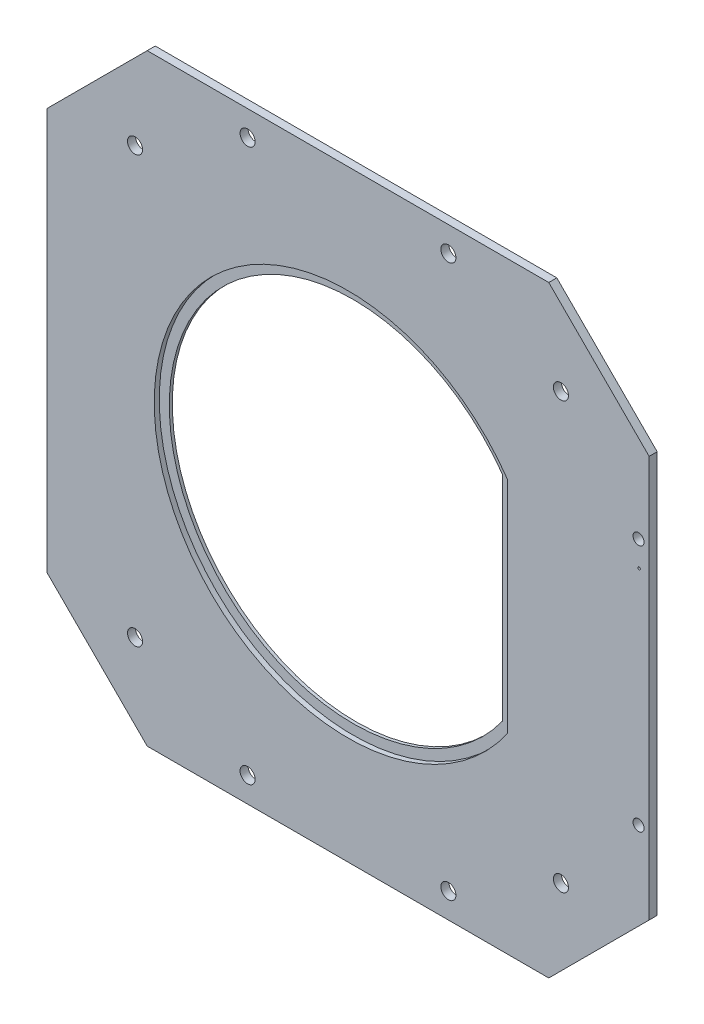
SolidWorks part; units mm, degrees
ref_plane "Front" through (0, 0, 0) normal (0, 0, 1) x (1, 0, 0)
ref_plane "Top" through (0, 0, 0) normal (0, 1, 0) x (1, 0, 0)
ref_plane "Right" through (0, 0, 0) normal (1, 0, 0) x (0, 0, -1)
sketch "Sketch1" plane through (0, 0, 0) normal (0, 0, 1) x (1, 0, 0)
  line L0 (-60, -40) -> (-40, -60)
  line L1 (-40, 60) -> (40, 60)
  line L2 (-60, 40) -> (-60, -40)
  line L3 (-40, -60) -> (40, -60)
  line L4 (60, 40) -> (60, -40)
  line L5 (40, -60) -> (60, -40)
  line L6 (40, 60) -> (60, 40)
  line L7 (-60, 40) -> (-40, 60)
  point P0 (-60, 60)
  point P1 (60, -60)
  point P2 (-60, -60)
  point P3 (60, 60)
  dimension "D1" = 120
  dimension "D2" = 120
  dimension "D3" = 60
  dimension "D4" = 60
  dimension "D7" = 20
  dimension "D8" = 20
  dimension "D9" = 20
  dimension "D10" = 20
extrude "Extrude1" add sketch "Sketch1" along normal blind 1.6
sketch "Sketch2" plane through (0, 0, 1.6) normal (0, 0, 1) x (1, 0, 0)
  line L0 (29.75, 21.3189) -> (29.75, -21.3189)
  arc A0 (29.75, 21.3189) -> (29.75, -21.3189) centre (0, 0) ccw
  dimension "D1" = 73.2
  dimension "D2" = 29.75
extrude "Cut-Extrude1" cut sketch "Sketch2" against normal through all
sketch "Sketch3" plane through (0, 0, 1.6) normal (0, 0, 1) x (1, 0, 0)
  line L0 (29.75, 21.3189) -> (29.75, -21.3189) construction
  line L1 (29.75, 21.3189) -> (29.75, -21.3189) construction
  line L2 (31.75, 21.9522) -> (31.75, -21.9522)
  arc A0 (29.75, 21.3189) -> (29.75, -21.3189) centre (0, 0) ccw construction
  arc A1 (29.75, 21.3189) -> (29.75, -21.3189) centre (0, 0) ccw construction
  arc A2 (31.75, 21.9522) -> (31.75, -21.9522) centre (0, 0) ccw
  dimension "D1" = 2
extrude "Cut-Extrude2" cut sketch "Sketch3" against normal blind 1
hole_wizard "Ø3.0 (3) Diameter Hole1" positions "Sketch5" profile "Sketch4" hole size "Ø3.0" standard "Ansi Metric"
sketch "Sketch5" plane through (0, 0, 1.6) normal (0, 0, 1) x (1, 0, 0)
  line L0 (42.4264, 42.4264) -> (-42.4264, -42.4264)
  line L1 (0, 0) -> (0, 60)
  line L2 (-42.4264, 42.4264) -> (42.4264, -42.4264)
  line L3 (40, 60) -> (-40, 60) construction
  line L4 (-40, -60) -> (40, -60) construction
  circle A0 centre (0, 0) radius 60
  point P0 (-42.4264, 42.4264)
  point P1 (-20, 55)
  point P3 (20, 55)
  point P5 (42.4264, 42.4264)
  point P7 (42.4264, -42.4264)
  point P9 (20, -55)
  point P11 (-20, -55)
  point P13 (-42.4264, -42.4264)
  dimension "D1" = 120
  dimension "D2" = 45
  dimension "D3" = 5
  dimension "D4" = 20
  dimension "D5" = 20
  dimension "D6" = 5
sketch "Sketch4" plane through (-42.4264, 42.4264, 1.6) normal (1, 0, 0) x (0, -1, 0)
  line L0 (0, 0) -> (0, 45.3513)
  line L1 (0, 45.3513) -> (1.5, 44.45)
  line L2 (1.5, 44.45) -> (1.5, 0)
  line L5 (1.5, 0) -> (0, 0)
  line L10 (0, 45.3513) -> (-1.5, 44.45) construction
  line L11 (0, -6.35) -> (0, 107.95) construction
  dimension "Hole Dia." = 3
  dimension "Hole Depth" = 44.45
  dimension "Drill Angle" = 118
sketch "Sketch6" plane through (0, 0, 1.6) normal (0, 0, 1) x (1, 0, 0)
  line L0 (0, 0) -> (60, 0) construction
  line L1 (60, -40) -> (60, 40) construction
  circle A0 centre (58, 19.685) radius 0.25
  dimension "D1" = 0.5
  dimension "D2" = 2
  dimension "D3" = 19.685
extrude "Cut-Extrude3" cut sketch "Sketch6" against normal through all
hole_wizard "Ø2.2 (2.2) Diameter Hole1" positions "Sketch8" profile "Sketch7" hole size "Ø2.2" standard "Ansi Metric"
sketch "Sketch8" plane through (0, 0, 1.6) normal (0, 0, 1) x (1, 0, 0)
  point P1 (57.89, -24.685)
  point P4 (57.89, 24.685)
sketch "Sketch7" plane through (57.89, -24.685, 1.6) normal (1, 0, 0) x (0, -1, 0)
  line L0 (0, 0) -> (0, 1.6)
  line L1 (0, 1.6) -> (1.1, 1.6)
  line L2 (1.1, 1.6) -> (1.1, 0)
  line L5 (1.1, 0) -> (0, 0)
  line L11 (0, -6.35) -> (0, 107.95) construction
  dimension "Thru Hole Dia." = 2.2
  dimension "Thru Hole Depth" = 1.6
equation "\"D3@Sketch1\" = \"D1@Sketch1\"/2"
equation "\"D4@Sketch1\" = \"D2@Sketch1\"/2"
